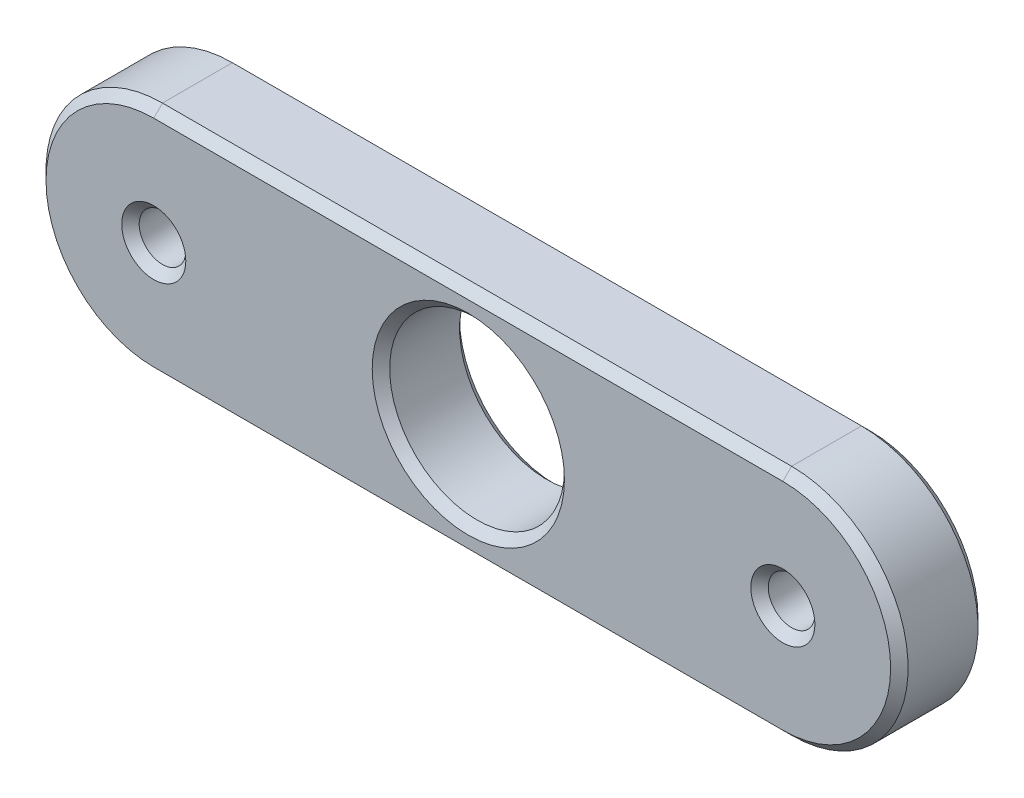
SolidWorks part; units mm, degrees
ref_plane "Plan de face" through (0, 0, 0) normal (0, 0, 1) x (1, 0, 0)
ref_plane "Plan de dessus" through (0, 0, 0) normal (0, 1, 0) x (1, 0, 0)
ref_plane "Plan de droite" through (0, 0, 0) normal (1, 0, 0) x (0, 0, -1)
sketch "Esquisse1" plane through (0, 0, 0) normal (0, 0, 1) x (1, 0, 0)
  line L0 (27, 0) -> (-27, 0) construction
  line L1 (27, -10) -> (-27, -10)
  line L2 (27, 10) -> (-27, 10)
  arc A0 (27, -10) -> (27, 10) centre (27, 0) ccw
  arc A1 (-27, 10) -> (-27, -10) centre (-27, 0) ccw
  circle A2 centre (-27, 0) radius 2
  circle A3 centre (0, 0) radius 2 construction
  circle A4 centre (27, 0) radius 2
  circle A5 centre (0, 0) radius 7.5
  point P2 (0, 0)
  dimension "D2" = 10
  dimension "D3" = 4
  dimension "D4" = 15
  dimension "D1" = 54
extrude "Boss.-Extru.1" add sketch "Esquisse1" along normal blind 7.5
chamfer "Chanfrein1" distance 0.75 angle 45 14 edges at (29, 0, 0) (-25, 0, 0) (0, 10, 0) (-37, 0, 0) (0, -10, 0) (37, 0, 0) (29, 0, 7.5) (-25, 0, 7.5) (0, -10, 7.5) (-37, 0, 7.5) (0, 10, 7.5) (37, 0, 7.5) (7.5, 0, 0) (7.5, 0, 7.5)
